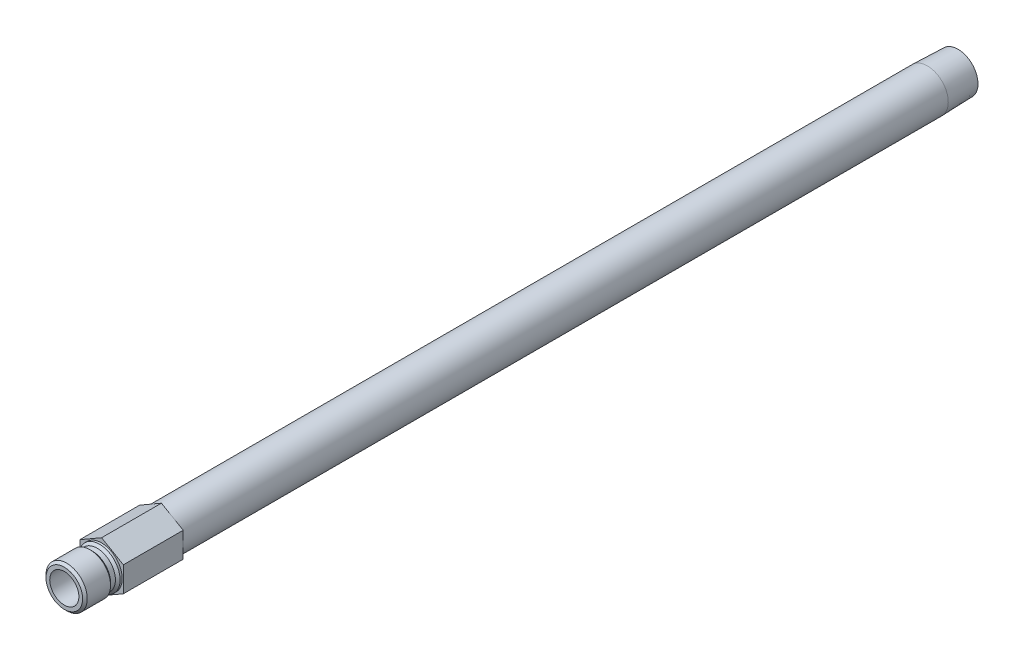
SolidWorks part; units mm, degrees
ref_plane "Front Plane" through (0, 0, 0) normal (0, 0, 1) x (1, 0, 0)
ref_plane "Top Plane" through (0, 0, 0) normal (0, 1, 0) x (1, 0, 0)
ref_plane "Right Plane" through (0, 0, 0) normal (1, 0, 0) x (0, 0, -1)
sketch "Sketch1" plane through (0, 0, 0) normal (1, 0, 0) x (0, 0, -1)
  line L0 (0, 0) -> (-15.367, 0) construction
  line L1 (-12.192, 4.7625) -> (-12.192, 5.9817)
  line L2 (-3.048, 5.9817) -> (-3.048, 0) construction
  line L3 (-11.43, 6.7437) -> (-3.81, 6.7437)
  line L4 (0, 6.858) -> (0, 4.7625) construction
  line L5 (-3.048, 5.9817) -> (-1.4605, 5.9817)
  line L6 (-0.6985, 6.7437) -> (0, 6.7437)
  line L7 (0, 6.7437) -> (0, 6.858)
  line L8 (-3.048, 5.9817) -> (-3.81, 6.7437)
  line L9 (-1.4605, 5.9817) -> (-0.6985, 6.7437)
  line L10 (-12.192, 5.9817) -> (-11.43, 6.7437)
  line L11 (-12.192, 4.7625) -> (0, 4.7625)
  line L12 (0, 6.858) -> (269.875, 6.858)
  line L13 (269.875, 6.858) -> (279.908, 6.5445)
  line L14 (279.908, 6.5445) -> (279.908, 4.6228)
  line L15 (0, 6.7437) -> (19.558, 6.7437) construction
  line L16 (19.558, 6.7437) -> (19.558, 0) construction
  line L17 (19.558, 0) -> (0, 0) construction
  line L19 (0.0743, 4.6228) -> (279.908, 4.6228)
  line L20 (0, 4.7625) -> (0.0743, 4.6228)
  line L21 (0, 4.6272) -> (0, 0) construction
  dimension "D2" = 1.5875
  dimension "D3" = 0.762
  dimension "D4" = 45
  dimension "D5" = 9.144
  dimension "D6" = 45
  dimension "D7" = 1.79
  dimension "D8" = 10.033
  dimension "D9" = 292.1
  dimension "D10" = 3.175
  dimension "D11" = 9.525
  dimension "D12" = 13.716
  dimension "D13" = 31.75
  dimension "D14" = 13.4874
  dimension "D15" = 9.2456
  dimension "D16" = 19.558
  dimension "D17" = 118
  dimension "D18" = 12.192
revolve "Revolve1" add sketch "Sketch1" angle 360 about L0
sketch "Sketch2" plane through (0, 0, 0) normal (0, 0, 1) x (1, 0, 0)
  line L1 (-7.112, 4.1061) -> (-7.112, -4.1061)
  line L2 (-7.112, -4.1061) -> (0, -8.2122)
  line L3 (0, -8.2122) -> (7.112, -4.1061)
  line L4 (7.112, -4.1061) -> (7.112, 4.1061)
  line L5 (7.112, 4.1061) -> (0, 8.2122)
  line L6 (0, 8.2122) -> (-7.112, 4.1061)
  circle A0 centre (0, 0) radius 7.112 construction
  circle A1 centre (0, 0) radius 4.6228 construction
  circle A2 centre (0, 0) radius 4.6228
  dimension "D1" = 14.224
extrude "Boss-Extrude1" add sketch "Sketch2" against normal up to vertex (19.558 mm away) from vertex at 0
